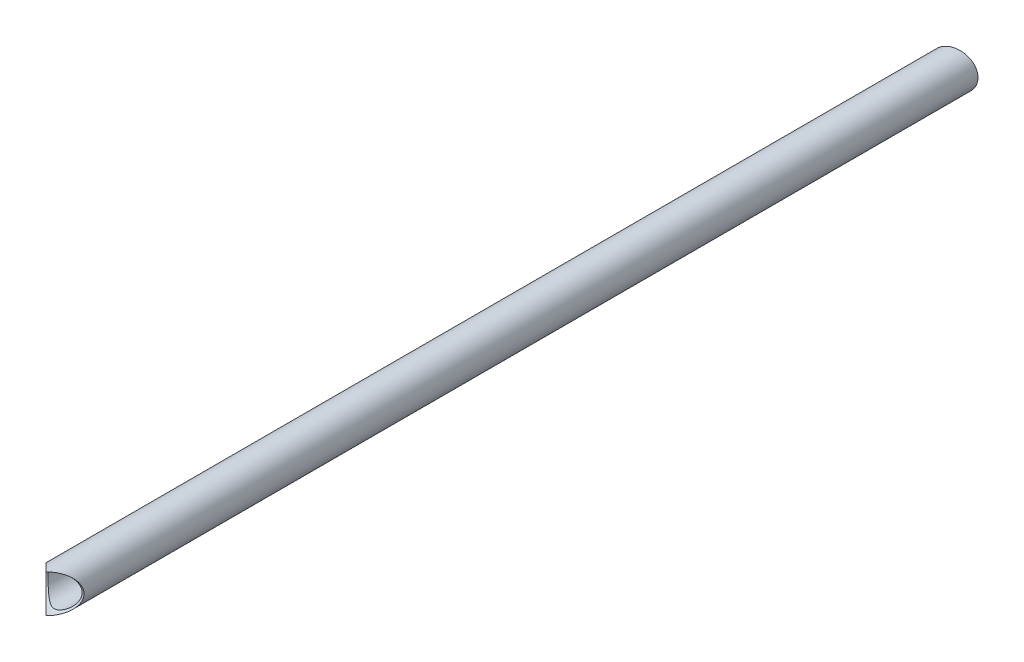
SolidWorks part; units mm, degrees
ref_plane "Vorne" through (0, 0, 0) normal (0, 0, 1) x (1, 0, 0)
ref_plane "Oben" through (0, 0, 0) normal (0, 1, 0) x (1, 0, 0)
ref_plane "Rechts" through (0, 0, 0) normal (1, 0, 0) x (0, 0, -1)
sketch "Skizze2" plane through (0, 0, 0) normal (0, 0, 1) x (1, 0, 0)
  circle A0 centre (0, 0) radius 15
  circle A1 centre (0, 0) radius 13.5
  dimension "FR1-DM" = 30
  dimension "FR1-WS" = 1.5
extrude "Aufsatz-Linear austragen1" add sketch "Skizze2" along normal mid plane 720
sketch "Skizze3" plane through (0, 0, 0) normal (1, 0, 0) x (0, 0, -1)
  line L0 (-360, 15) -> (-360, -15) construction
  circle A0 centre (-360, 0) radius 15
extrude "Schnitt-Linear austragen1" cut sketch "Skizze3" against normal mid plane 40
sketch "Skizze4" plane through (0, 0, 0) normal (0, 1, 0) x (1, 0, 0)
  line L0 (15, 360) -> (-15, 351.9615)
  line L1 (-15, 360) -> (-15, -345) construction
  line L2 (15, 360) -> (-15, 360) construction
  dimension "D1" = 15
extrude "Schnitt-Linear austragen2" cut sketch "Skizze4" against normal through all and the other way through all flip side to cut
sketch "Skizze5" plane through (-88.9952, 0, -332.1346) normal (-0.2588, 0, -0.9659) x (-0.9659, 0, 0.2588)
  line L0 (-107.6637, 0) -> (-76.6055, 0) construction
  ellipse E0 centre (-92.1346, 0) end of major axis (-107.6637, 0) minor radius 15 construction
